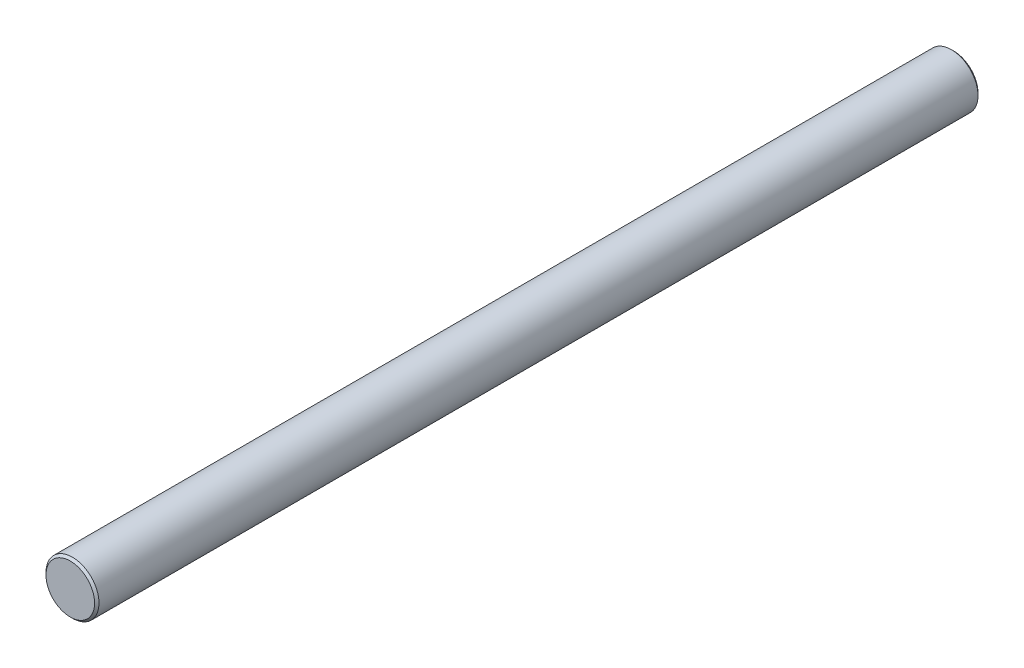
SolidWorks part; units mm, degrees
ref_plane "Спереди" through (0, 0, 0) normal (0, 0, 1) x (1, 0, 0)
ref_plane "Сверху" through (0, 0, 0) normal (0, 1, 0) x (1, 0, 0)
ref_plane "Справа" through (0, 0, 0) normal (1, 0, 0) x (0, 0, -1)
sketch "Эскиз1" plane through (0, 0, 0) normal (0, 0, 1) x (1, 0, 0)
  circle A0 centre (0, 0) radius 3
  dimension "D1" = 6
extrude "Бобышка-Вытянуть1" add sketch "Эскиз1" along normal blind 100
chamfer "Фаска1" distance 0.25 angle 45 2 edges at (3, 0, 0) (3, 0, 100)
